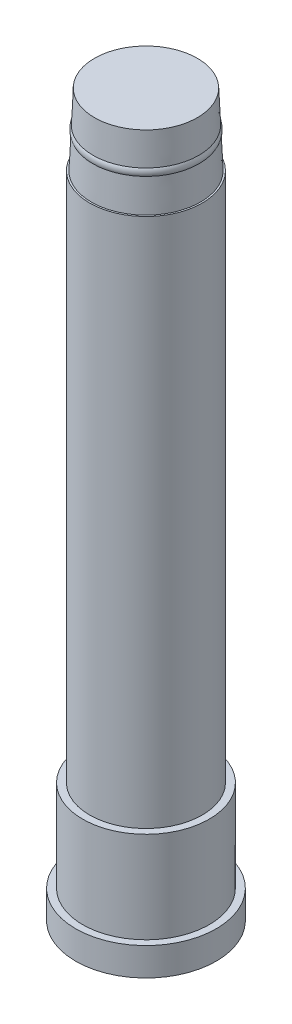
SolidWorks part; units mm, degrees
ref_plane "Face" through (0, 0, 0) normal (0, 0, 1) x (1, 0, 0)
ref_plane "Dessus" through (0, 0, 0) normal (0, 1, 0) x (1, 0, 0)
ref_plane "Droite" through (0, 0, 0) normal (1, 0, 0) x (0, 0, -1)
sketch "Esquisse1" plane through (0, 0, 0) normal (0, 0, 1) x (1, 0, 0)
  line L0 (0, 49.4323) -> (0, -48.5112) construction
  line L1 (0, 0) -> (-10, 0)
  line L2 (-10, 0) -> (-10, 4)
  line L3 (-10, 4) -> (-8, 4)
  line L4 (-8, 4) -> (-8, 104)
  line L5 (-8, 104) -> (0, 104)
  line L6 (0, 104) -> (0, 0)
  dimension "D1" = 104
  dimension "D2" = 4
  dimension "D3" = 20
  dimension "D4" = 16
revolve "Base-Révolution" add sketch "Esquisse1" angle 360 about L0
other "Empreinte1"
other "Porte_clef_G_r1-8<1>@creation empreintes1"
sketch "Esquisse2" plane through (0, 4, 0) normal (0, 1, 0) x (1, 0, 0)
  circle A0 centre (0, 0) radius 9
  dimension "D1" = 18
extrude "Boss.-Extru.1" add sketch "Esquisse2" along normal blind 13
